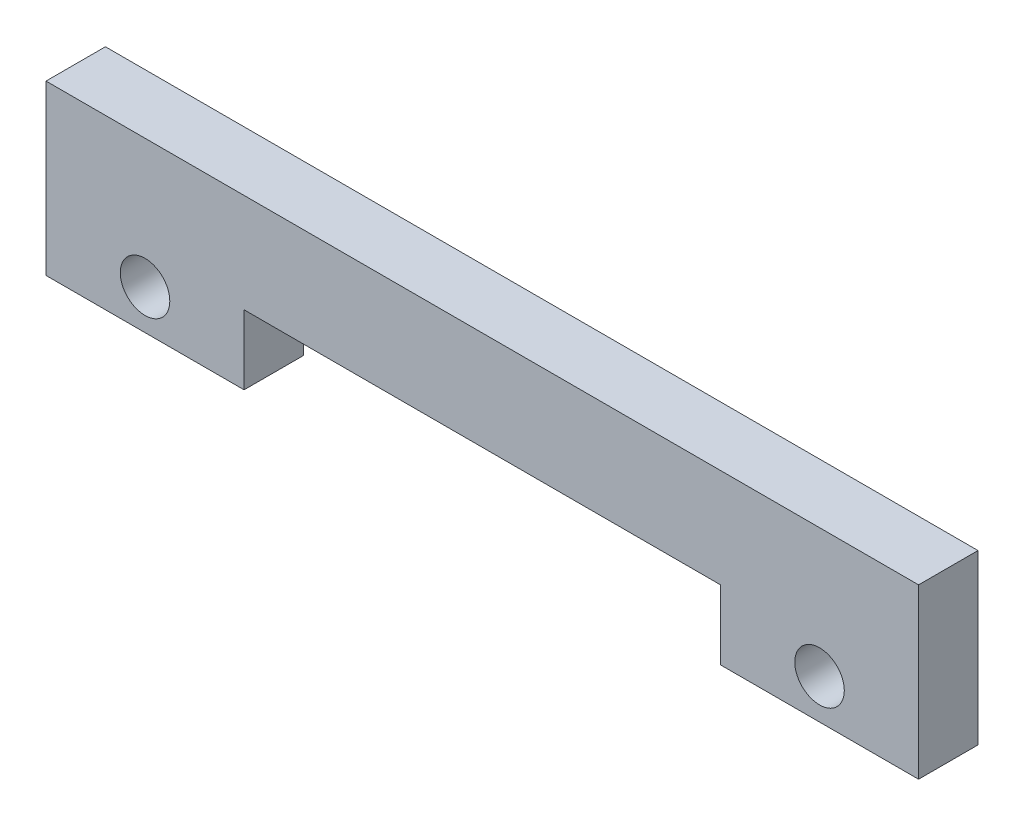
SolidWorks part; units mm, degrees
ref_plane "Front Plane" through (0, 0, 0) normal (0, 0, 1) x (1, 0, 0)
ref_plane "Top Plane" through (0, 0, 0) normal (0, 1, 0) x (1, 0, 0)
ref_plane "Right Plane" through (0, 0, 0) normal (1, 0, 0) x (0, 0, -1)
sketch "Sketch1" plane through (0, 0, 0) normal (0, 0, 1) x (1, 0, 0)
  line L189 (87.4134, 261.7073) -> (87.4134, 270.2073)
  line L190 (77.4134, 261.7073) -> (77.4134, 265.2073)
  line L191 (53.3613, 261.7073) -> (53.3613, 265.2073)
  line L192 (43.3613, 261.7073) -> (43.3613, 270.2073)
  line L193 (43.3613, 270.2073) -> (87.4134, 270.2073)
  line L195 (43.3613, 261.7073) -> (53.3613, 261.7073)
  line L196 (77.4134, 261.7073) -> (87.4134, 261.7073)
  line L204 (77.4134, 265.2073) -> (53.3613, 265.2073)
  circle A40 centre (48.3613, 263.7073) radius 1.25
  circle A41 centre (82.4134, 263.7073) radius 1.25
extrude "Boss-Extrude1" add sketch "Sketch1" along normal blind 3
